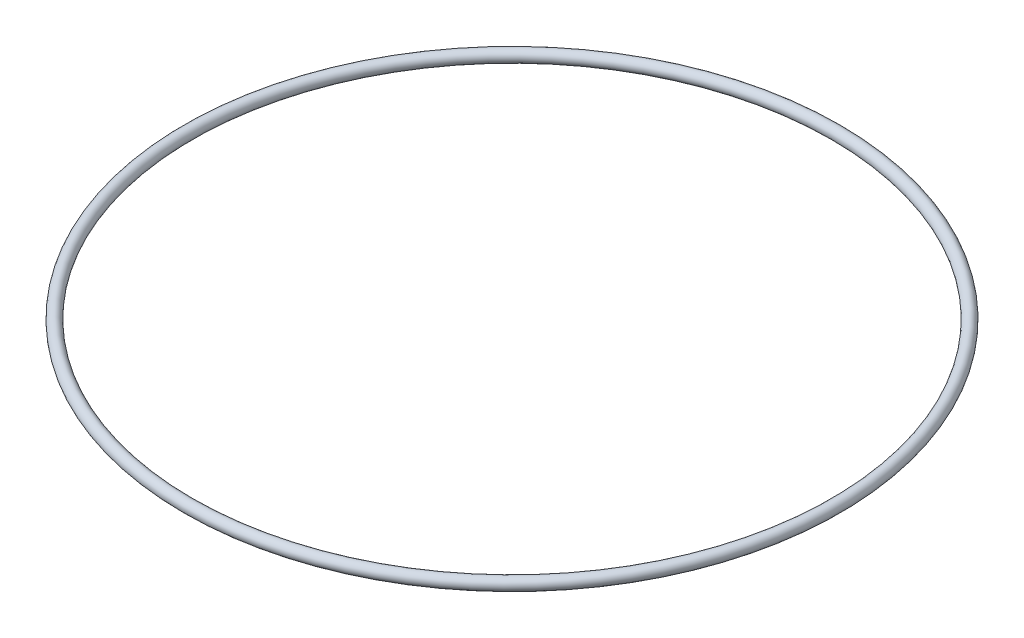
SolidWorks part; units mm, degrees
ref_plane "Plan1" through (0, 0, 0) normal (0, 0, 1) x (1, 0, 0)
ref_plane "Plan2" through (0, 0, 0) normal (0, 1, 0) x (1, 0, 0)
ref_plane "Plan3" through (0, 0, 0) normal (1, 0, 0) x (0, 0, -1)
sketch "Esquisse1" plane through (0, 0, 0) normal (0, 0, 1) x (1, 0, 0)
  line L1 (0, 0) -> (160, 0) construction
  line L2 (0, 1.5) -> (0, -1.5) construction
  circle A0 centre (81.5, 0) radius 1.5
  dimension "D2" = 81.5
  dimension "D1" = 3
  dimension "Diamètre du tore" = 3
  dimension "Diamètre intérieur" = 160
revolve "Base-Révolution" add sketch "Esquisse1" angle 360 about L2
equation " \"D1@Esquisse1\"=\"Diamètre du tore@Esquisse1\" "
equation "\"D2@Esquisse1\" = (\"Diamètre intérieur@Esquisse1\"/2)+(\"Diamètre du tore@Esquisse1\"/2)"
